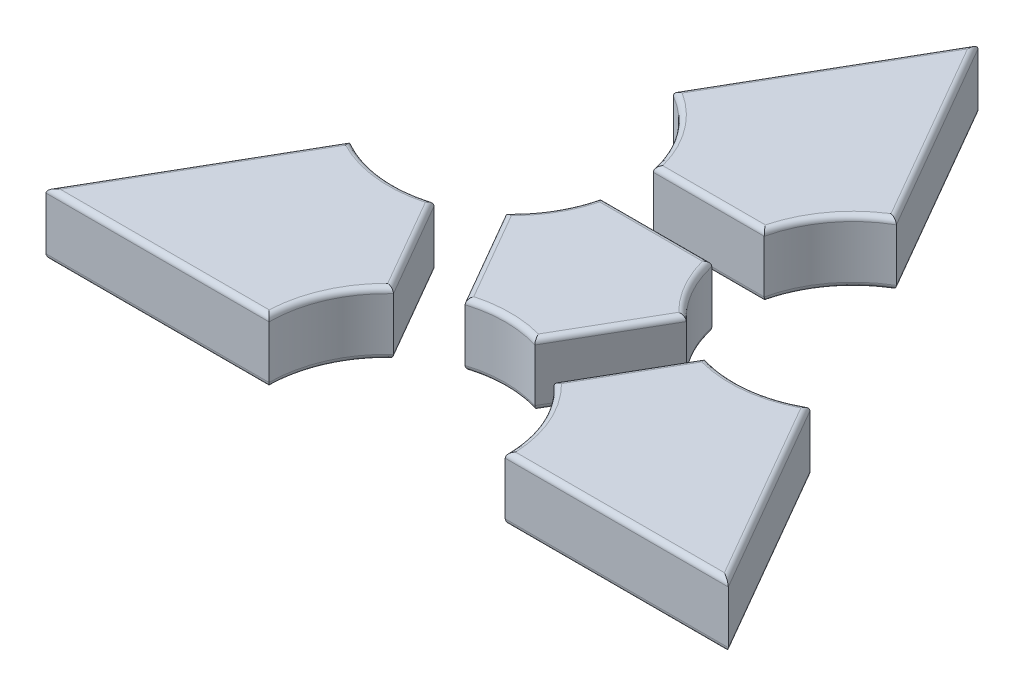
SolidWorks part; units mm, degrees
other "Kamera1"
ref_plane "Y" through (0, 0, 0) normal (0, 0, 1) x (1, 0, 0)
ref_plane "Z" through (0, 0, 0) normal (0, 1, 0) x (1, 0, 0)
ref_plane "X" through (0, 0, 0) normal (1, 0, 0) x (0, 0, -1)
sketch "Skizze1" plane through (0, 0, 0) normal (0, 1, 0) x (1, 0, 0)
  line L0 (-65, -37.5278) -> (-22.5, -37.5278)
  line L1 (65, -37.5278) -> (43.75, -0.7217)
  line L2 (0, 75.0555) -> (-21.25, 38.2495)
  line L3 (0, 0) -> (0, 31.6724) construction
  line L4 (-17.4892, 0) -> (15.1431, 0) construction
  line L5 (65, -37.5278) -> (-58.9814, 34.0529) construction
  line L6 (-43.75, -0.7217) -> (-65, -37.5278)
  line L7 (22.5, -37.5278) -> (65, -37.5278)
  line L8 (21.25, 38.2495) -> (0, 75.0555)
  line L9 (-65, -37.5278) -> (61.9246, 35.7522) construction
  line L10 (-32.5, 18.7639) -> (32.5, 18.7639) construction
  line L11 (32.5, 18.7639) -> (0, -37.5278) construction
  line L12 (0, -37.5278) -> (-32.5, 18.7639) construction
  line L13 (-10.5626, 13.7639) -> (10.5626, 13.7639)
  line L14 (-10.5626, 23.7639) -> (10.5626, 23.7639)
  line L15 (-6.6386, -16.0294) -> (-17.2012, 2.2655)
  line L16 (-15.2988, -21.0294) -> (-25.8614, -2.7345)
  line L17 (17.2012, 2.2655) -> (6.6386, -16.0294)
  line L18 (25.8614, -2.7345) -> (15.2988, -21.0294)
  arc A0 (-43.75, -0.7217) -> (-25.8614, -2.7345) centre (-32.5, 18.7639) ccw
  arc A1 (21.25, 38.2495) -> (10.5626, 23.7639) centre (32.5, 18.7639) ccw
  arc A2 (22.5, -37.5278) -> (15.2988, -21.0294) centre (0, -37.5278) ccw
  arc A3 (-17.2012, 2.2655) -> (-10.5626, 13.7639) centre (-32.5, 18.7639) ccw
  arc A4 (-15.2988, -21.0294) -> (-22.5, -37.5278) centre (0, -37.5278) ccw
  arc A5 (25.8614, -2.7345) -> (43.75, -0.7217) centre (32.5, 18.7639) ccw
  arc A6 (6.6386, -16.0294) -> (-6.6386, -16.0294) centre (0, -37.5278) ccw
  arc A7 (10.5626, 13.7639) -> (17.2012, 2.2655) centre (32.5, 18.7639) ccw
  arc A8 (-10.5626, 23.7639) -> (-21.25, 38.2495) centre (-32.5, 18.7639) ccw
  dimension "D1" = 45
  dimension "D2" = 130
  dimension "D3" = 130
extrude "Platte" add sketch "Skizze1" along normal blind 12
fillet "Verrundung1" radius 1 10 edges at (-43.75, 0, 37.5278) (-20.6213, 0, 28.527) (-20.5801, 0, 11.8819) (-35.0158, 0, 3.595) (-54.375, 0, 19.1247) (-35.0158, 12, 3.595) (-20.5801, 12, 11.8819) (-20.6213, 12, 28.527) (-43.75, 12, 37.5278) (-54.375, 12, 19.1247)
fillet "Verrundung2" radius 1 10 edges at (14.3945, 12, -32.1221) (0, 12, -23.7639) (-14.3945, 12, -32.1221) (-10.625, 12, -56.6525) (10.625, 12, -56.6525) (-10.625, 0, -56.6525) (-14.3945, 0, -32.1221) (0, 0, -23.7639) (14.3945, 0, -32.1221) (10.625, 0, -56.6525)
fillet "Verrundung3" radius 1 10 edges at (54.375, 0, 19.1247) (35.0158, 0, 3.595) (20.5801, 0, 11.8819) (20.6213, 0, 28.527) (43.75, 0, 37.5278) (20.6213, 12, 28.527) (20.5801, 12, 11.8819) (35.0158, 12, 3.595) (54.375, 12, 19.1247) (43.75, 12, 37.5278)
fillet "Verrundung4" radius 1 12 edges at (0, 12, -13.7639) (13.0144, 12, -7.5139) (11.9199, 12, 6.8819) (0, 12, 15.0278) (-11.9199, 12, 6.8819) (-13.0144, 12, -7.5139) (-11.9199, 0, 6.8819) (0, 0, 15.0278) (11.9199, 0, 6.8819) (13.0144, 0, -7.5139) (0, 0, -13.7639) (-13.0144, 0, -7.5139)
ref_plane "Ebene1" through (0, 100, 0) normal (0, 1, 0) x (-1, 0, 0)
sketch "Skizze2" plane through (0, 100, 0) normal (0, 1, 0) x (-1, 0, 0)
  circle A0 centre (0, 0) radius 190
  dimension "D1" = 380
